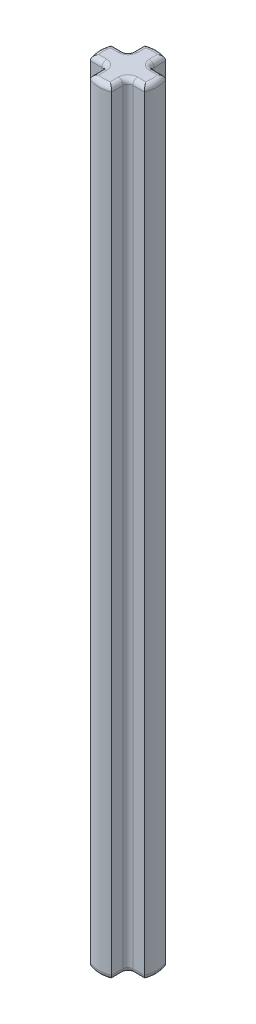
SolidWorks part; units mm, degrees
ref_plane "Front Plane" through (0, 0, 0) normal (0, 0, 1) x (1, 0, 0)
ref_plane "Top Plane" through (0, 0, 0) normal (0, 1, 0) x (1, 0, 0)
ref_plane "Right Plane" through (0, 0, 0) normal (1, 0, 0) x (0, 0, -1)
sketch "Sketch1" plane through (0, 0, 0) normal (0, 1, 0) x (1, 0, 0)
  line L8 (-2.2328, 0.88) -> (-0.88, 0.88)
  line L9 (2.2328, -0.88) -> (0.88, -0.88)
  line L10 (-0.88, 2.2328) -> (-0.88, 0.88)
  line L11 (-0.88, -0.88) -> (-0.88, -2.2328)
  line L12 (0.88, -2.2328) -> (0.88, -0.88)
  line L13 (0.88, 0.88) -> (2.2328, 0.88)
  line L14 (0.88, 0.88) -> (0.88, 2.2328)
  line L15 (-0.88, -0.88) -> (-2.2328, -0.88)
  arc A4 (2.2328, -0.88) -> (2.2328, 0.88) centre (0, 0) ccw
  arc A5 (0.88, 2.2328) -> (-0.88, 2.2328) centre (0, 0) ccw
  arc A6 (-2.2328, 0.88) -> (-2.2328, -0.88) centre (0, 0) ccw
  arc A7 (-0.88, -2.2328) -> (0.88, -2.2328) centre (0, 0) ccw
  dimension "D1" = 0.88
  dimension "D2" = 1.76
  dimension "D3" = 0.88
  dimension "D4" = 1.76
extrude "Boss-Extrude1" add sketch "Sketch1" along normal blind 64
fillet "Fillet7" radius 0.4 28 edges at (-1.5564, 0, -0.88) (-2.4, 0, 0) (-1.5564, 0, 0.88) (-0.88, 0, 1.5564) (0, 0, 2.4) (0.88, 0, 1.5564) (1.5564, 0, 0.88) (2.4, 0, 0) (1.5564, 0, -0.88) (0.88, 0, -1.5564) (0, 0, -2.4) (-0.88, 0, -1.5564) (0, 64, -2.4) (0.88, 64, -1.5564) (1.5564, 64, -0.88) (2.4, 64, 0) (1.5564, 64, 0.88) (0.88, 64, 1.5564) (0, 64, 2.4) (-0.88, 64, 1.5564) (-1.5564, 64, 0.88) (-2.4, 64, 0) (-1.5564, 64, -0.88) (-0.88, 64, -1.5564) (-0.88, 32, -0.88) (0.88, 32, 0.88) (-0.88, 32, 0.88) (0.88, 32, -0.88)
